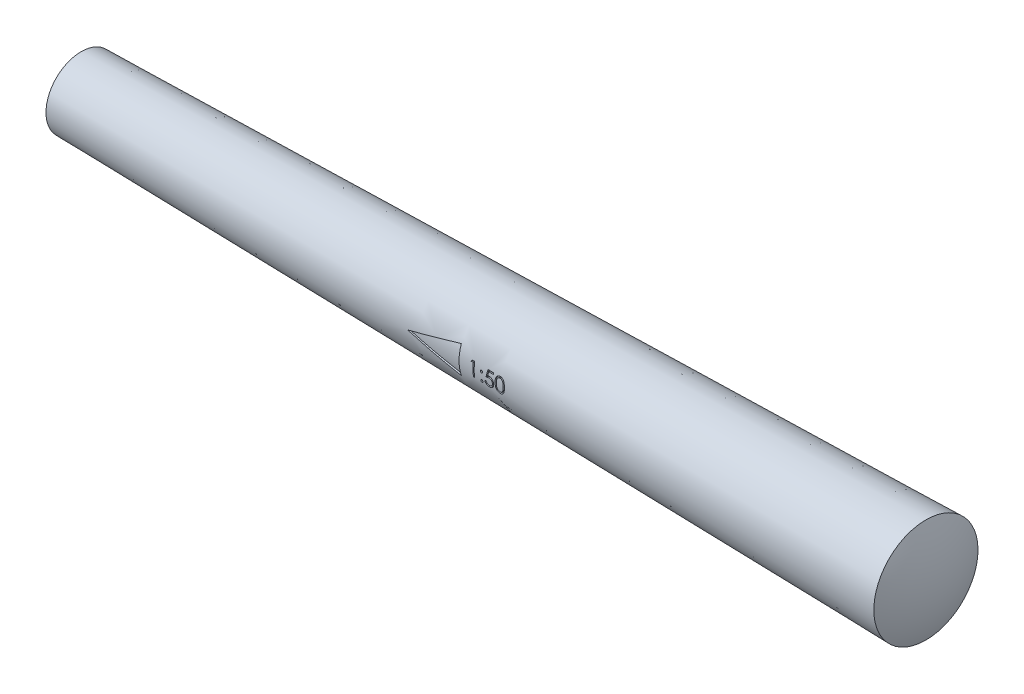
SolidWorks part; units mm, degrees
ref_plane "Front Plane" through (0, 0, 0) normal (0, 0, 1) x (1, 0, 0)
ref_plane "Top Plane" through (0, 0, 0) normal (0, 1, 0) x (1, 0, 0)
ref_plane "Right Plane" through (0, 0, 0) normal (1, 0, 0) x (0, 0, -1)
sketch "Sketch1" plane through (0, 0, 0) normal (1, 0, 0) x (0, 0, -1)
  circle A0 centre (0, 0) radius 2.5
  dimension "D1" = 5
extrude "Extrude1" add sketch "Sketch1" along normal mid plane 60
draft "Draft1" type of draft neutral plane draft angle 1.146 faces to draft 1 parameters "D1"=1.146
sketch "Sketch2" plane through (0, 0, 0) normal (0, 0, 1) x (1, 0, 0)
  line L0 (-30, 0) -> (-30, 2.5)
  line L1 (-30, 2.5) -> (-30, -2.5) construction
  line L2 (-30, 0) -> (-30.75, 0)
  line L3 (-30.75, 0) -> (-30.75, -3.1) construction
  line L4 (30, 0) -> (30, 3.7)
  line L5 (30, -3.7) -> (30, 3.7) construction
  line L6 (30, 0) -> (30.75, 0)
  line L7 (30.75, 0) -> (30.75, -3.1) construction
  line L8 (-30, -2.5) -> (30, -3.7) construction
  arc A0 (-30.75, 0) -> (-30, 2.5) centre (-26.2083, 0) cw
  arc A1 (30.75, 0) -> (30, 3.7) centre (21.2481, 0) ccw
  point P14 (0, -3.1)
revolve "Revolve1" add sketch "Sketch2" angle 360 about L2
sketch "Sketch5" plane through (0, 0, 0) normal (0, 0, 1) x (1, 0, 0)
  line L0 (0, 3.1) -> (0, -3.1) construction
  line L1 (30, 3.7) -> (-30, 2.5) construction
  line L2 (-30, -2.5) -> (30, -3.7) construction
ref_plane "Plane2" through (0, 0, 0) normal (-0.02, 0, 0.9998) x (0.9998, 0, 0.02)
sketch "Sketch6" plane through (0, 0, 0) normal (-0.02, 0, 0.9998) x (0.9998, 0, 0.02)
  line L0 (0, 0) -> (0, 1)
  line L1 (0, 3.1) -> (0, -3.1) construction
  line L2 (0, 1) -> (-3.7321, 0)
  line L3 (-3.7321, 0) -> (0, -1)
  line L4 (0, -1) -> (0, 0)
  line L5 (0, -0.5) -> (4, -0.5) construction
  text T0 "1:50" font "Century Gothic" height 1
  dimension "D1" = 2
  dimension "D2" = 30
  dimension "D3" = 4
wrap "Wrap2" sketch "Sketch6" wrap type deboss source sketch "Sketch6" thickness 0.1 parameters "D1"=0.1
equation "\"D2@Sketch2\" = \"D1@Sketch2\""
